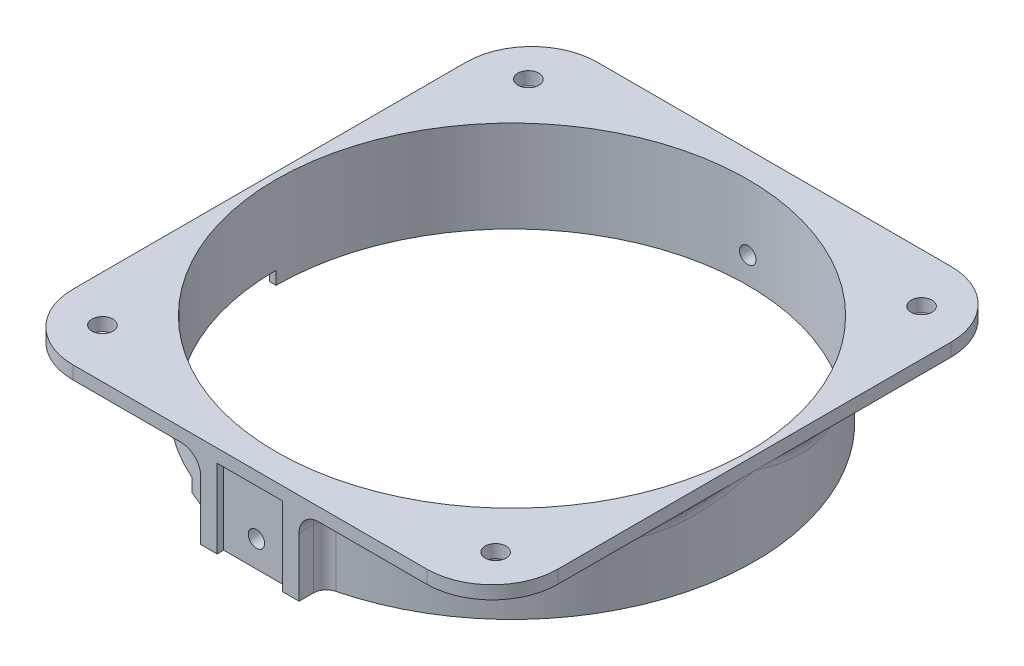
SolidWorks part; units mm, degrees
ref_plane "前视基准面" through (0, 0, 0) normal (0, 0, 1) x (1, 0, 0)
ref_plane "上视基准面" through (0, 0, 0) normal (0, 1, 0) x (1, 0, 0)
ref_plane "右视基准面" through (0, 0, 0) normal (1, 0, 0) x (0, 0, -1)
sketch "草图1" plane through (0, 0, 0) normal (0, 1, 0) x (1, 0, 0)
  circle A0 centre (0, 0) radius 36
  circle A1 centre (0, 0) radius 37
  dimension "D1" = 72
  dimension "D2" = 74
extrude "凸台-拉伸1" add sketch "草图1" along normal blind 14
sketch "草图2" plane through (0, 0, 0) normal (0, 1, 0) x (1, 0, 0)
  line L0 (-74.8137, 0) -> (0, 0) construction
  line L1 (0, 0) -> (0, -90.7206) construction
  line L3 (-37, 0) -> (-15, 0)
  line L4 (-37, 0) -> (-37, -40.3453)
  line L5 (-37, -40.3453) -> (-15, -40.3453)
  line L6 (-15, 0) -> (-15, -40.3453)
  circle A0 centre (0, 0) radius 37 construction
  dimension "D1" = 22
extrude "切除-拉伸1" cut sketch "草图2" along normal blind 2
sketch "草图3" plane through (0, 14, 0) normal (0, 1, 0) x (1, 0, 0)
  line L0 (0, -75.1314) -> (0, 57.0329) construction
  line L1 (57.2671, 0) -> (-67.0606, 0) construction
  line L2 (7.5, 40) -> (-7.5, 36.2319) construction
  line L3 (7.5, -40) -> (-7.5, -40)
  line L4 (7.5, -40) -> (7.5, -36.2319)
  line L5 (7.5, -36.2319) -> (-7.5, -36.2319)
  line L6 (-7.5, -40) -> (-7.5, -36.2319)
  line L7 (7.5, -40) -> (-7.5, -36.2319) construction
  line L8 (7.5, -36.2319) -> (-7.5, -40) construction
  line L9 (7.5, 40) -> (7.5, 36.2319)
  line L10 (7.5, 40) -> (-7.5, 40)
  line L11 (7.5, 36.2319) -> (-7.5, 40) construction
  line L12 (-7.5, 40) -> (-7.5, 36.2319)
  line L13 (7.5, 36.2319) -> (-7.5, 36.2319)
  circle A0 centre (0, 0) radius 37 construction
  point P5 (0, -38.1159)
  point P17 (0, 38.1159)
  dimension "D1" = 80
  dimension "D2" = 15
extrude "凸台-拉伸2" add sketch "草图3" against normal up to surface (14 mm away)
sketch "草图4" plane through (0, 14, 0) normal (0, 1, 0) x (1, 0, 0)
  line L0 (0, -71.6557) -> (0, 76.2439) construction
  line L1 (77.9233, 0) -> (-76.0365, 0) construction
  line L2 (7.5, 40) -> (-7.5, 40) construction
  line L3 (5, 39) -> (-5, 39)
  line L4 (5, 39) -> (5, 40)
  line L5 (5, 40) -> (-5, 40)
  line L6 (-5, 39) -> (-5, 40)
  line L7 (5, 39) -> (-5, 40) construction
  line L8 (5, 40) -> (-5, 39) construction
  line L9 (5, -40) -> (-5, -39) construction
  line L10 (5, -39) -> (-5, -40) construction
  line L11 (-5, -39) -> (-5, -40)
  line L12 (5, -40) -> (-5, -40)
  line L13 (5, -39) -> (5, -40)
  line L14 (5, -39) -> (-5, -39)
  point P5 (0, 39.5)
  point P16 (0, -39.5)
  dimension "D1" = 1
  dimension "D2" = 10
extrude "切除-拉伸2" cut sketch "草图4" against normal through all
fillet "圆角1" radius 2 4 edges at (-7.5, 7, 36.2319) (7.5, 7, 36.2319) (-7.5, 7, -36.2319) (7.5, 7, -36.2319)
sketch "草图5" plane through (0, 0, -39) normal (0, 0, -1) x (-1, 0, 0)
  line L0 (0, 22.5027) -> (0, -7.2445) construction
  line L1 (5, 0) -> (-5, 0) construction
  circle A0 centre (0, 4) radius 1.25
  circle A1 centre (0, 14) radius 1.25
  dimension "D1" = 2.5
  dimension "D2" = 4
  dimension "D3" = 10
extrude "切除-拉伸3" cut sketch "草图5" against normal through all
ref_plane "基准面1" through (0, 14, 0) normal (0, 1, 0) x (1, 0, 0)
sketch "草图6" plane through (0, 14, 0) normal (0, 1, 0) x (1, 0, 0)
  line L0 (-5, 40) -> (-7.5, 40) construction
  line L1 (37, -40) -> (-37, -40)
  line L2 (37, -40) -> (37, 40)
  line L3 (37, 40) -> (-37, 40)
  line L4 (-37, -40) -> (-37, 40)
  line L5 (37, -40) -> (-37, 40) construction
  line L6 (37, 40) -> (-37, -40) construction
  line L17 (1.25, -35.9783) -> (1.25, -39)
  line L18 (1.25, -35.9783) -> (1.25, -39)
  line L19 (1.25, -39) -> (5, -39)
  line L20 (1.25, -39) -> (5, -39)
  line L21 (5, -39) -> (5, -40)
  line L22 (5, -40) -> (7.5, -40)
  line L23 (7.5, -40) -> (7.5, -37.8253)
  line L24 (7.5, 37.8253) -> (7.5, 40)
  line L25 (7.5, 40) -> (5, 40)
  line L26 (5, 40) -> (5, 39)
  line L27 (5, 39) -> (1.25, 39)
  line L28 (1.25, 39) -> (1.25, 35.9783)
  line L29 (1.25, 39) -> (1.25, 35.9783)
  line L35 (5, -39) -> (5, -40)
  line L36 (5, -40) -> (7.5, -40)
  line L37 (7.5, -40) -> (7.5, -37.8253)
  line L38 (7.5, 37.8253) -> (7.5, 40)
  line L39 (7.5, 40) -> (5, 40)
  line L40 (5, 40) -> (5, 39)
  line L41 (5, 39) -> (1.25, 39)
  arc A0 (-9.0128, 35.8855) -> (-9.0128, -35.8855) centre (0, 0) ccw construction
  arc A5 (1.25, -35.9783) -> (1.25, 35.9783) centre (0, 0) ccw
  arc A6 (1.25, -35.9783) -> (1.25, 35.9783) centre (0, 0) ccw
  arc A7 (9.0128, -35.8855) -> (7.5, -37.8253) centre (9.5, -37.8253) ccw
  arc A8 (9.0128, -35.8855) -> (9.0128, 35.8855) centre (0, 0) ccw
  arc A9 (7.5, 37.8253) -> (9.0128, 35.8855) centre (9.5, 37.8253) ccw
  arc A13 (9.0128, -35.8855) -> (7.5, -37.8253) centre (9.5, -37.8253) ccw
  arc A14 (9.0128, -35.8855) -> (9.0128, 35.8855) centre (0, 0) ccw
  arc A15 (7.5, 37.8253) -> (9.0128, 35.8855) centre (9.5, 37.8253) ccw
  point P0 (0, 0)
  dimension "D1" = 0
extrude "凸台-拉伸3" add sketch "草图6" against normal blind 2
fillet "圆角2" radius 10 4 edges at (-37, 13, 40) (37, 13, 40) (37, 13, -40) (-37, 13, -40)
sketch "草图7" plane through (0, 14, 0) normal (0, 1, 0) x (1, 0, 0)
  line L0 (0, 64.1626) -> (0, -66.2253) construction
  line L1 (-55.2969, 0) -> (65.2681, 0) construction
  circle A0 centre (-30, 32.5) radius 1.6
  circle A1 centre (30, 32.5) radius 1.6
  circle A2 centre (30, -32.5) radius 1.6
  circle A3 centre (-30, -32.5) radius 1.6
  circle A4 centre (0, 0) radius 36
  dimension "D1" = 3.2
  dimension "D2" = 60
  dimension "D3" = 65
  dimension "D4" = 72
extrude "切除-拉伸4" cut sketch "草图7" against normal through all
fillet "圆角3" radius 3 12 edges at (-7.5, 12, -38.9126) (-7.9229, 12, -36.5953) (-29.176, 12, -22.7544) (-7.5, 12, 38.9126) (-7.9229, 12, 36.5953) (7.5, 12, 38.9126) (7.9229, 12, 36.5953) (7.5, 12, -38.9126) (7.9229, 12, -36.5953) (29.176, 12, -22.7544) (-29.176, 12, 22.7544) (29.176, 12, 22.7544)
